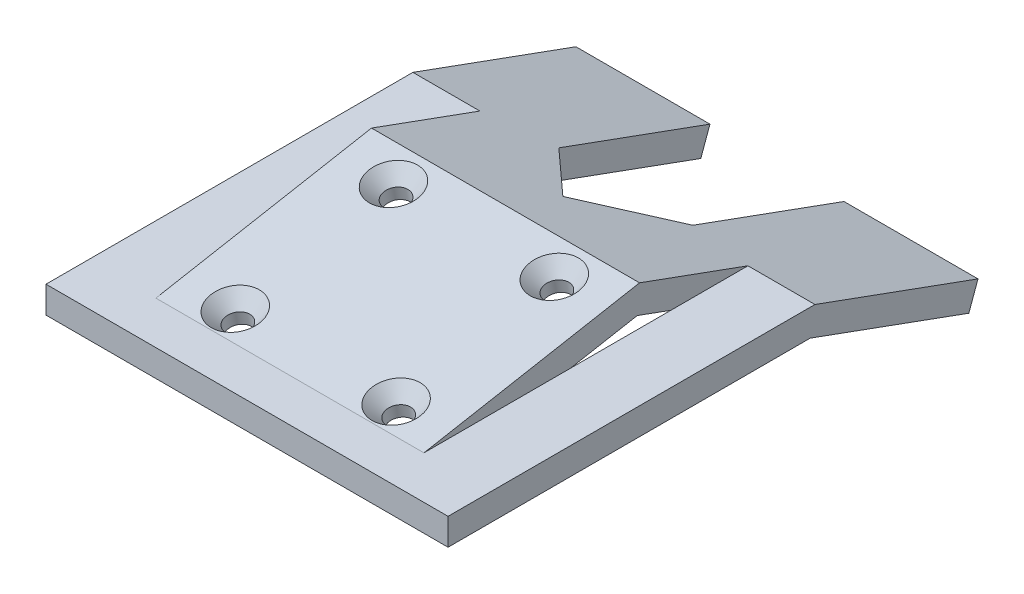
SolidWorks part; units mm, degrees
ref_plane "Front Plane" through (0, 0, 0) normal (0, 0, 1) x (1, 0, 0)
ref_plane "Top Plane" through (0, 0, 0) normal (0, 1, 0) x (1, 0, 0)
ref_plane "Right Plane" through (0, 0, 0) normal (1, 0, 0) x (0, 0, -1)
sketch "Sketch1" plane through (0, 0, 0) normal (1, 0, 0) x (0, 0, -1)
  line L0 (0, 0) -> (68, 0)
  line L1 (68, 0) -> (98, -10.9191)
  dimension "D1" = 68
  dimension "D2" = 30
  dimension "D4" = 20
sketch "Sketch2" plane through (0, 0, 0) normal (0, 0, 1) x (1, 0, 0)
  line L1 (-37.5, -2.5) -> (37.5, -2.5)
  line L2 (-37.5, -2.5) -> (-37.5, 2.5)
  line L3 (-37.5, 2.5) -> (37.5, 2.5)
  line L4 (37.5, -2.5) -> (37.5, 2.5)
  line L5 (-37.5, -2.5) -> (37.5, 2.5) construction
  line L6 (-37.5, 2.5) -> (37.5, -2.5) construction
  point P0 (0, 0)
  dimension "D1" = 75
  dimension "D2" = 5
sweep "main" add profiles "Sketch2" path "Sketch1"
sketch "Sketch3" plane through (0, 2.5, 0) normal (0, 1, 0) x (1, 0, 0)
  line L0 (37.5, 0) -> (-37.5, 0) construction
  line L1 (-25, 8) -> (25, 8)
  line L2 (-25, 8) -> (-25, 68.4408)
  line L3 (-25, 68.4408) -> (25, 68.4408)
  line L4 (25, 8) -> (25, 68.4408)
  line L5 (-25, 8) -> (25, 68.4408) construction
  line L6 (-25, 68.4408) -> (25, 8) construction
  line L7 (37.5, 68.4408) -> (-37.5, 68.4408) construction
  point P0 (0, 38.2204)
  dimension "D1" = 50
  dimension "D3" = 8
extrude "center cutout" cut sketch "Sketch3" against normal through all
sketch "Sketch4" plane through (0, 0, 0) normal (1, 0, 0) x (0, 0, -1)
  line L0 (8, 2.5) -> (48.2204, 9.8596)
  line L1 (48.2204, 9.8596) -> (68.4408, 2.5)
  line L2 (8, 2.5) -> (68.4408, 2.5) construction
  point P5 (38.2204, 2.5)
  dimension "D1" = 10
  dimension "D2" = 20
sketch "Sketch5" plane through (0, 0, -8) normal (0, 0, -1) x (-1, 0, 0)
  line L4 (-25, -2.5) -> (25, -2.5)
  line L5 (25, -2.5) -> (25, 2.5)
  line L6 (25, 2.5) -> (-25, 2.5)
  line L7 (25, -2.5) -> (25, 2.5)
  line L8 (-25, -2.5) -> (25, -2.5)
  line L9 (-25, 2.5) -> (-25, -2.5)
  line L10 (25, 2.5) -> (-25, 2.5)
  line L11 (-25, 2.5) -> (-25, -2.5)
  dimension "D1" = 0
sweep "lifted sweep" add profiles "Sketch5" path "Sketch4"
hole_wizard "CSK for #8 Flat Head Socket Cap Screw1" positions "Sketch7" profile "Sketch6" countersink size "#8" standard "Ansi Inch"
sketch "Sketch7" plane through (0, 1.0026, 0.1835) normal (0, 0.9837, 0.18) x (-1, 0, 0)
  line L0 (25, -49.2075) -> (25, -8.3193) construction
  line L1 (25, -49.2075) -> (-25, -49.2075) construction
  point P0 (15, -43.2075)
  point P1 (-15, -43.2075)
  point P3 (15, -13.2075)
  point P5 (-15, -13.2075)
  dimension "D1" = 30
  dimension "D2" = 30
  dimension "D3" = 10
  dimension "D4" = 6
sketch "Sketch6" plane through (-15, 8.7797, -42.3184) normal (1, 0, 0) x (0, -0.18, 0.9837)
  line L0 (0, 0) -> (0, 31.8642)
  line L1 (0, 31.8642) -> (2.2479, 31.8642)
  line L2 (2.2479, 31.8642) -> (2.2479, 2.659)
  line L3 (2.2479, 2.659) -> (4.5593, 0)
  line L5 (4.5593, 0) -> (0, 0)
  line L6 (-2.2479, 2.659) -> (-4.5593, 0) construction
  line L11 (0, -6.35) -> (0, 107.95) construction
  dimension "Thru Hole Dia." = 4.4958
  dimension "Thru Hole Depth" = 31.8642
  dimension "Near C'Sink Dia." = 9.1186
  dimension "Near C'Sink Angle" = 82
sketch "Sketch8" plane through (0, 24.204, -8.8095) normal (0, 0.9397, -0.342) x (1, 0, 0)
  line L0 (12.5, 95.8244) -> (12.5, 65.8244)
  line L1 (-37.5, 95.8244) -> (37.5, 95.8244) construction
  line L2 (12.5, 65.8244) -> (0, 53.3244)
  line L3 (0, 53.3244) -> (-12.5, 65.8244)
  line L4 (-12.5, 65.8244) -> (-12.5, 95.8244)
  line L5 (-12.5, 95.8244) -> (12.5, 95.8244)
  point P4 (0, 95.8244)
  dimension "D1" = 30
  dimension "D2" = 25
extrude "shank cutout" cut sketch "Sketch8" against normal through all
